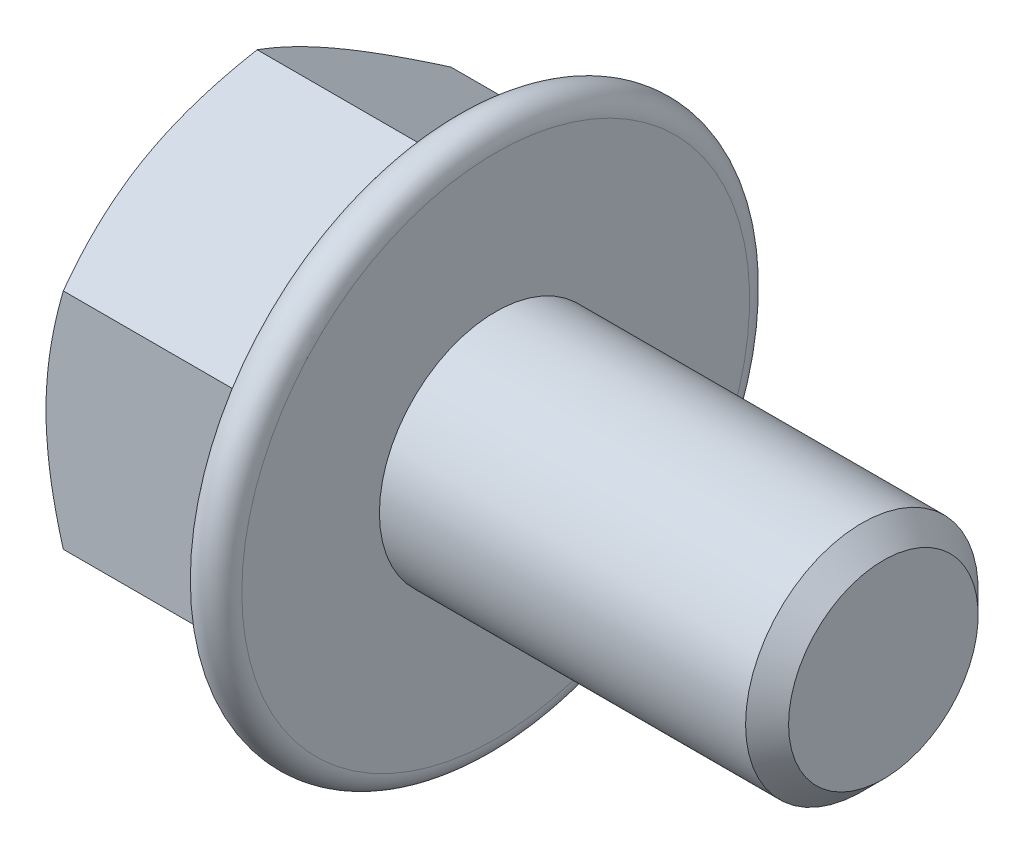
SolidWorks part; units mm, degrees
extrude "BaseHead" add sketch "Sketch1" along normal blind 6.6
sketch "Sketch1" plane through (0, 0, 0) normal (1, 0, 0) x (0, 0, -1)
  line L0 (5, 2.8868) -> (5, -2.8868)
  line L1 (-5, 2.8868) -> (-5, -2.8868)
  line L2 (5, -2.8868) -> (0, -5.7735)
  line L3 (0, -5.7735) -> (-5, -2.8868)
  line L4 (5, 2.8868) -> (0, 5.7735)
  line L5 (0, 5.7735) -> (-5, 2.8868)
ref_plane "Plane1" through (0, 0, 0) normal (0, 0, 1) x (1, 0, 0)
ref_plane "Plane2" through (0, 0, 0) normal (0, 1, 0) x (1, 0, 0)
ref_plane "Plane3" through (0, 0, 0) normal (1, 0, 0) x (0, 0, -1)
sketch "BodySke" plane through (0, 0, 0) normal (0, 0, 1) x (1, 0, 0)
  line L0 (0, 2.8868) -> (0, -2.8868) construction
  line L1 (0, 0) -> (16.6, 0)
  line L2 (0, 0) -> (0, 3)
  line L3 (0, 3) -> (16.0455, 3)
  line L4 (16.6, 0) -> (16.6, 2.4455)
  line L5 (6.6, 5.7735) -> (6.6, 2.8868) construction
  line L6 (16.6, 2.4455) -> (16.0455, 3)
  line L7 (0, 0) -> (96.52, 0) construction
  line L8 (16.6, -2.4455) -> (16.0455, -3) construction
  line L9 (0, -3) -> (16.0455, -3) construction
  line L10 (7.6, 15.24) -> (7.6, -1.27) construction
  line L11 (6.6, 15.24) -> (6.6, -1.27) construction
  line L12 (6.6, 2.8868) -> (6.6, -2.8868) construction
revolve "BaseBody" add sketch "BodySke"
fillet "HeadFillet" [suppressed] radius 0.25
sketch "Sketch3" plane through (0, 0, 0) normal (0, 0, 1) x (1, 0, 0)
  line L0 (0, 5) -> (3.3333, 10.7735)
  line L1 (0, 5.7735) -> (0, 2.8868) construction
  line L2 (3.3333, 10.7735) -> (3.3333, 15.7735)
  line L3 (3.3333, 15.7735) -> (-10, 15.7735)
  line L4 (-10, 15.7735) -> (-10, 5)
  line L5 (-10, 5) -> (0, 5)
  line L6 (0, 0) -> (99.06, 0) construction
  line L7 (6.6, 5.7735) -> (0, 5.7735) construction
revolve "HeadChamfer" cut sketch "Sketch3" angle 360 about L6
sketch "Sketch4" plane through (0, 0, 0) normal (0, 0, 1) x (1, 0, 0)
  line L0 (3.0807, 0) -> (5.5332, 6.7381)
  line L1 (6.6, 5.7735) -> (6.6, 2.8868) construction
  line L2 (5.5, 34.3444) -> (5.5, 16.9779) construction
  line L3 (6.6, 0) -> (6.6, 6.55)
  line L4 (8.3021, 7.1) -> (20.1618, 7.1) construction
  line L5 (0, 0) -> (95.25, 0) construction
  line L6 (0, 0) -> (96.52, 0) construction
  line L7 (3.0807, 0) -> (6.6, 0)
  line L8 (8.3021, -7.1) -> (20.1618, -7.1) construction
  arc A0 (6.6, 6.55) -> (5.5332, 6.7381) centre (6.05, 6.55) ccw
  dimension "D1" = 20
  dimension "Flange_thickness" = 1.1
  dimension "Flange_dia" = 14.2
revolve "Flange" add sketch "Sketch4" angle 360 about L5
fillet "FlangeHexFillet" radius 0.4 6 edges
sketch "ThdSchSke" plane through (0, 0, 0) normal (0, 0, 1) x (1, 0, 0)
  line L0 (7.6, -2.4455) -> (7.2117, -3)
  line L1 (7.6, -2.4455) -> (7.9883, -3)
  line L2 (7.9883, -3) -> (7.9883, -3.75)
  line L3 (-3.175, 0) -> (5.1513, 0) construction
  line L5 (7.9883, -3.75) -> (7.2117, -3.75)
  line L6 (7.2117, -3.75) -> (7.2117, -3)
revolve "ThreadSchematic" [suppressed] cut sketch "ThdSchSke" angle 360 about L3
pattern_linear "ThdSchPat" [suppressed]
equation "\"D3@Sketch1\" = \"Width_flats@Sketch1\" / 2"
equation "\"D4@Sketch1\" = \"D3@Sketch1\""
equation "\"D5@Sketch1\" = \"D4@Sketch1\""
equation "\"Thread_minor@ThreadCosmetic\" = \"Minor_dia@BodySke\""
equation "\"D1@Sketch3\" = \"Width_flats@Sketch1\" / 2"
equation "\"Thread_length@ThreadCosmetic\" = ((sgn( (\"Length@BodySke\" - \"Advance@BodySke\" ) - \"Thread_nom@BodySke\" )-1)*( (\"Length@BodySke\" - \"Advance@BodySke\" ) - \"Thread_nom@BodySke\" ))/-2+ \"Thread_nom@BodySke\""
equation "\"Thread_minor@ThdSchSke\" = \"Minor_dia@BodySke\""
equation "\"Diameter@ThdSchSke\" = \"Diameter@BodySke\""
equation "\"Overcut@ThdSchSke\" = \"Diameter@BodySke\" * 1.25"
equation "\"Start@ThdSchSke\" = \"Head_ht@BaseHead\" + \"Length@BodySke\" - \"Thread_length@ThreadCosmetic\"  '---Non-countersunk---"
equation "\"Num_threads@ThdSchPat\" = int( \"Thread_length@ThreadCosmetic\" / \"Advance@BodySke\" + 0.999 )  + 1"
equation "\"Advance@ThdSchPat\" = \"Thread_length@ThreadCosmetic\" /  (\"Num_threads@ThdSchPat\" - 1) 'relax it"
equation "\"Num_threads@ThdSchPat\" = \"Num_threads@ThdSchPat\" - sgn( \"Num_threads@ThdSchPat\" - 1) '---chamfered tips only---"
